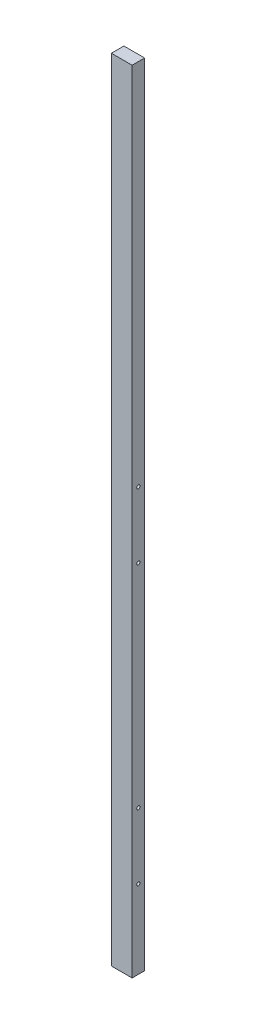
SolidWorks part; units mm, degrees
ref_plane "Front Plane" through (0, 0, 0) normal (0, 0, 1) x (1, 0, 0)
ref_plane "Top Plane" through (0, 0, 0) normal (0, 1, 0) x (1, 0, 0)
ref_plane "Right Plane" through (0, 0, 0) normal (1, 0, 0) x (0, 0, -1)
sketch "Sketch1" plane through (0, 0, 0) normal (0, 0, 1) x (1, 0, 0)
  line L1 (0, 0) -> (63, 0)
  line L2 (0, 0) -> (0, 2400)
  line L3 (0, 2400) -> (63, 2400)
  line L4 (63, 0) -> (63, 2400)
  dimension "D1" = 2400
  dimension "D2" = 63
extrude "Boss-Extrude1" add sketch "Sketch1" along normal blind 38
sketch "Sketch2" plane through (63, 0, 0) normal (1, 0, 0) x (0, 0, -1)
  circle A0 centre (-19, 238) radius 5 construction
  circle A1 centre (-19, 438) radius 5 construction
  circle A2 centre (-19, 1082) radius 5 construction
  circle A3 centre (-19, 1282) radius 5 construction
  circle A4 centre (-19, 238) radius 5
  circle A5 centre (-19, 438) radius 5
  circle A6 centre (-19, 1082) radius 5
  circle A7 centre (-19, 1282) radius 5
extrude "Cut-Extrude1" cut sketch "Sketch2" against normal up to next
